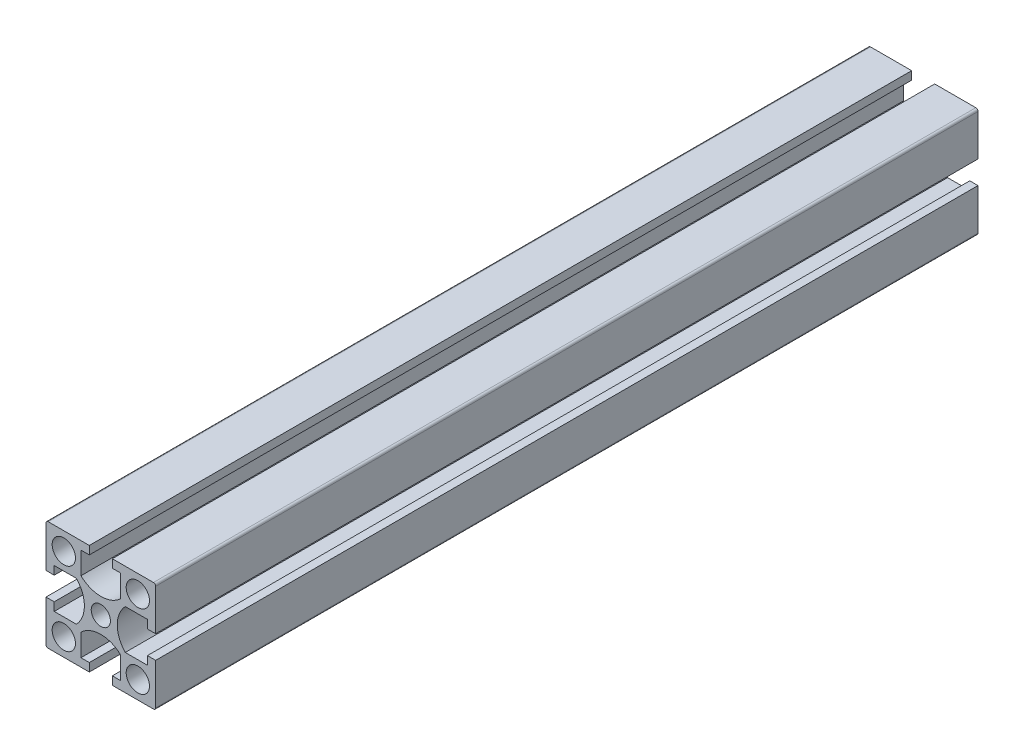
SolidWorks part; units mm, degrees
ref_plane "前视基准面" through (0, 0, 0) normal (0, 0, 1) x (1, 0, 0)
ref_plane "上视基准面" through (0, 0, 0) normal (0, 1, 0) x (1, 0, 0)
ref_plane "右视基准面" through (0, 0, 0) normal (1, 0, 0) x (0, 0, -1)
sketch "草图1" plane through (0, 0, 0) normal (0, 0, 1) x (1, 0, 0)
  line B0 (-17, 7.25) -> (-8.9048, 7.25)
  line B1 (-8.9048, -7.25) -> (-17, -7.25)
  line B2 (-17, -7.25) -> (-17, -4.2)
  line B3 (-17, -4.2) -> (-20, -4.2)
  line B4 (-20, -4.2) -> (-20, -19.2)
  line B5 (-19.2, -20) -> (-4.2, -20)
  line B6 (-4.2, -20) -> (-4.2, -17)
  line B7 (-4.2, -17) -> (-7.25, -17)
  line B8 (-7.25, -17) -> (-7.25, -8.9048)
  line B9 (7.25, -8.9048) -> (7.25, -17)
  line B10 (7.25, -17) -> (4.2, -17)
  line B11 (4.2, -17) -> (4.2, -20)
  line B12 (4.2, -20) -> (19.2, -20)
  line B13 (20, -19.2) -> (20, -4.2)
  line B14 (20, -4.2) -> (17, -4.2)
  line B15 (17, -4.2) -> (17, -7.25)
  line B16 (17, -7.25) -> (8.9048, -7.25)
  line B17 (8.9048, 7.25) -> (17, 7.25)
  line B18 (17, 7.25) -> (17, 4.2)
  line B19 (17, 4.2) -> (20, 4.2)
  line B20 (20, 4.2) -> (20, 19.2)
  line B21 (19.2, 20) -> (4.2, 20)
  line B22 (4.2, 20) -> (4.2, 17)
  line B23 (4.2, 17) -> (7.25, 17)
  line B24 (7.25, 17) -> (7.25, 8.9048)
  line B25 (-7.25, 8.9048) -> (-7.25, 17)
  line B26 (-7.25, 17) -> (-4.2, 17)
  line B27 (-4.2, 17) -> (-4.2, 20)
  line B28 (-4.2, 20) -> (-19.2, 20)
  line B29 (-20, 19.2) -> (-20, 4.2)
  line B30 (-20, 4.2) -> (-17, 4.2)
  line B31 (-17, 4.2) -> (-17, 7.25)
  arc B32 (-8.9048, -7.25) -> (-8.9048, 7.25) centre (-16.5, 0) ccw
  arc B33 (-20, -19.2) -> (-19.2, -20) centre (-19.2, -19.2) ccw
  arc B34 (7.25, -8.9048) -> (-7.25, -8.9048) centre (0, -16.5) ccw
  arc B35 (19.2, -20) -> (20, -19.2) centre (19.2, -19.2) ccw
  arc B36 (8.9048, 7.25) -> (8.9048, -7.25) centre (16.5, 0) ccw
  arc B37 (20, 19.2) -> (19.2, 20) centre (19.2, 19.2) ccw
  arc B38 (-7.25, 8.9048) -> (7.25, 8.9048) centre (0, 16.5) ccw
  arc B39 (-19.2, 20) -> (-20, 19.2) centre (-19.2, 19.2) ccw
  circle B40 centre (-13.5, -13.5) radius 4.25
  circle B41 centre (13.5, -13.5) radius 4.25
  circle B42 centre (-13.5, 13.5) radius 4.25
  arc B43 (-3.5, 0) -> (3.5, 0) centre (0, 0) ccw
  arc B44 (3.5, 0) -> (-3.5, 0) centre (0, 0) ccw
  circle B45 centre (13.5, 13.5) radius 4.25
sketch_block_instance "A$C730F3178-1"
sketch_block "A$C730F3178"
extrude "凸台-拉伸1" add sketch "草图1" along normal mid plane 300
